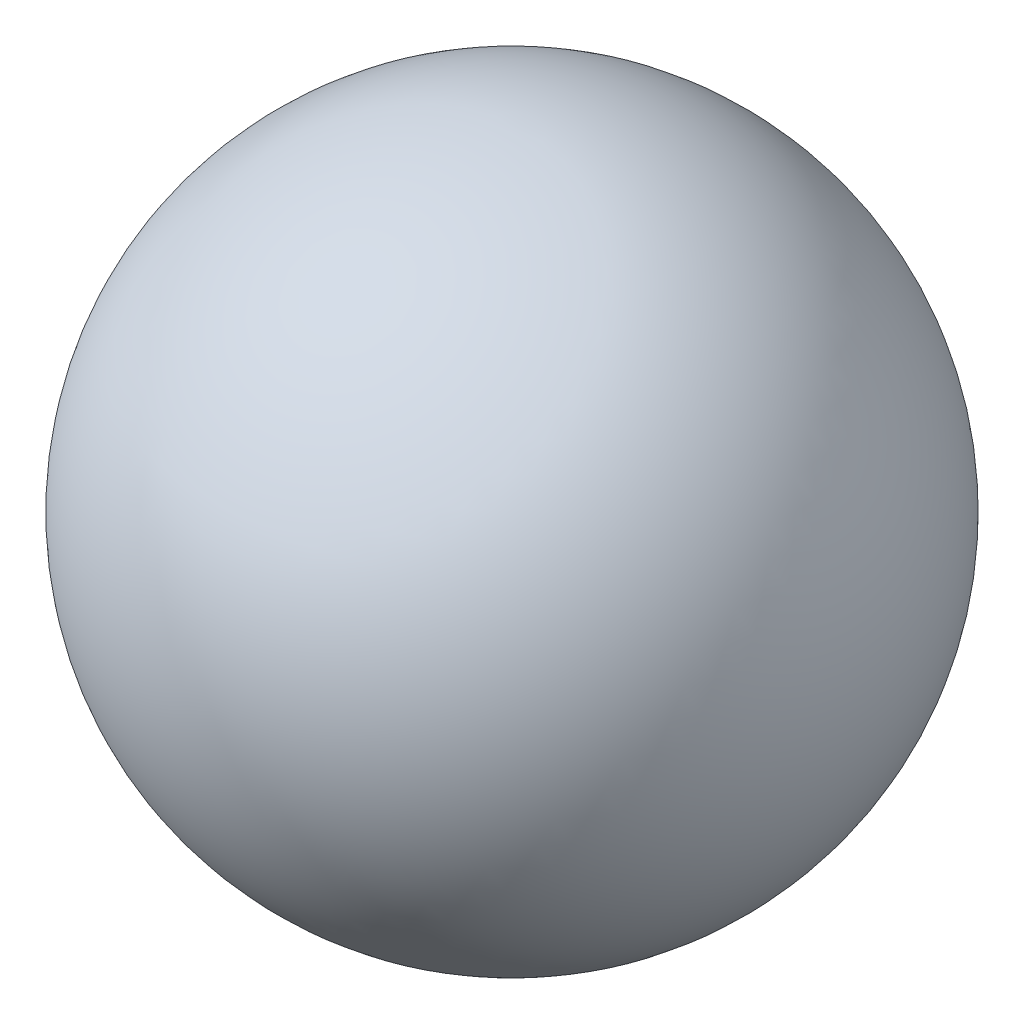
SolidWorks part; units mm, degrees
ref_plane "Front Plane" through (0, 0, 0) normal (0, 0, 1) x (1, 0, 0)
ref_plane "Top Plane" through (0, 0, 0) normal (0, 1, 0) x (1, 0, 0)
ref_plane "Right Plane" through (0, 0, 0) normal (1, 0, 0) x (0, 0, -1)
sketch "Sketch1" plane through (0, 0, 0) normal (0, 0, 1) x (1, 0, 0)
  line L0 (0, 3.175) -> (0, -3.097) construction
  circle A0 centre (0, 0) radius 3.175
  dimension "D1" = 6.35
surface "Surface-Revolve2" sketch "Sketch1" parameters "D1"=360
